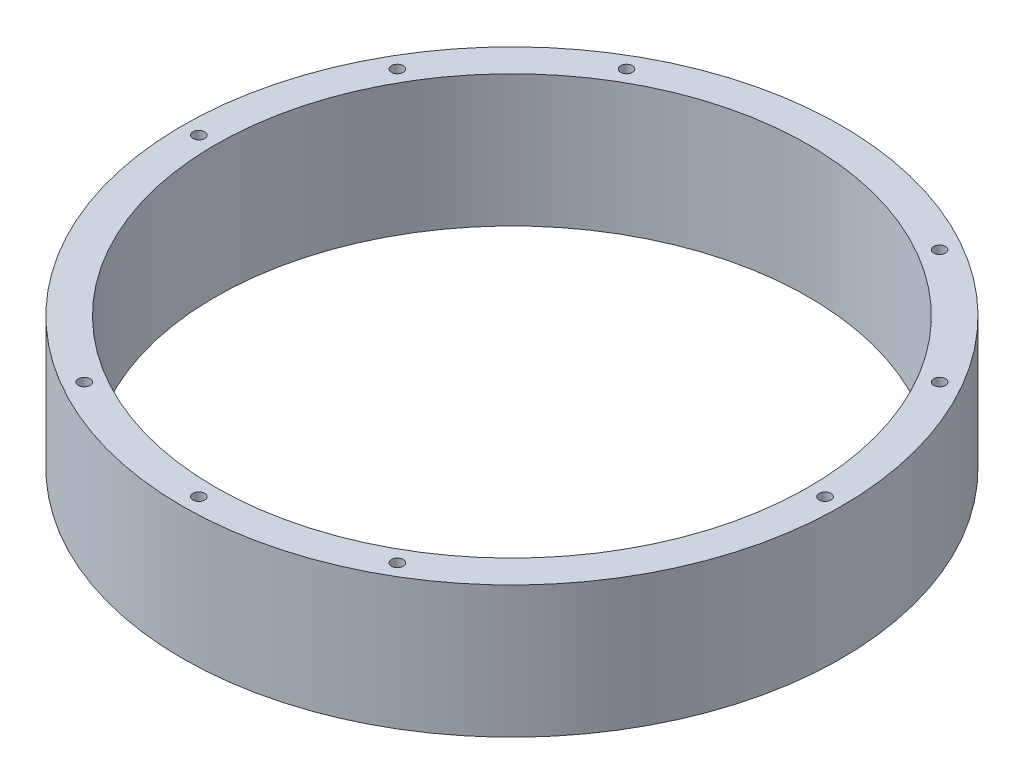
SolidWorks part; units mm, degrees
ref_plane "Front Plane" through (0, 0, 0) normal (0, 0, 1) x (1, 0, 0)
ref_plane "Top Plane" through (0, 0, 0) normal (0, 1, 0) x (1, 0, 0)
ref_plane "Right Plane" through (0, 0, 0) normal (1, 0, 0) x (0, 0, -1)
sketch "Sketch1" plane through (0, 0, 0) normal (0, 1, 0) x (1, 0, 0)
  circle A0 centre (0, 0) radius 57.15
  circle A1 centre (0, 0) radius 63.5
  dimension "D1" = 127
  dimension "D2" = 114.3
extrude "Boss-Extrude1" add sketch "Sketch1" along normal blind 25.4
sketch "Sketch2" plane through (0, 25.4, 0) normal (0, 1, 0) x (1, 0, 0)
  line L0 (0, 0) -> (0, -69.8914) construction
  line L1 (0, 0) -> (-30.1625, -52.243) construction
  line L2 (0, 0) -> (30.1625, -52.243) construction
  circle A1 centre (0, 0) radius 60.325 construction
  circle A2 centre (0, -60.325) radius 1.1303
  circle A3 centre (-30.1625, -52.243) radius 1.1303
  circle A4 centre (30.1625, -52.243) radius 1.1303
  circle A5 centre (-30.1625, 52.243) radius 1.1303
  circle A6 centre (-52.243, 30.1625) radius 1.1303
  circle A7 centre (-60.325, 0) radius 1.1303
  circle A8 centre (60.325, 0) radius 1.1303
  circle A9 centre (52.243, 30.1625) radius 1.1303
  circle A10 centre (30.1625, 52.243) radius 1.1303
  point P25 (0, 0)
  dimension "D1" = 120.65
  dimension "D4" = 2.2606
  dimension "D5" = 2.2606
  dimension "D6" = 2.2606
  dimension "D2" = 30
  dimension "D3" = 30
  dimension "D7" = 3
extrude "Cut-Extrude1" cut sketch "Sketch2" against normal through all
sketch "Sketch3" plane through (0, 0, 0) normal (0, 0, 1) x (1, 0, 0)
  line L0 (0, 0) -> (0, 25.4) construction
  line L2 (63.5, 25.4) -> (-63.5, 25.4) construction
  line L3 (63.5, 12.7) -> (-63.5, 12.7) construction
  line L6 (63.5, 0) -> (63.5, 25.4) construction
  line L7 (-63.5, 25.4) -> (-63.5, 0) construction
  line L8 (69.85, 13.4938) -> (-69.85, 13.4938)
  line L10 (69.85, 11.9063) -> (-69.85, 11.9063)
  arc A12 (-69.85, 11.9063) -> (-69.85, 13.4938) centre (-69.85, 12.7) cw
  arc A13 (69.85, 11.9063) -> (69.85, 13.4938) centre (69.85, 12.7) ccw
  point P15 (0, 13.4938)
  point P16 (0, 11.9063)
  dimension "D5" = 139.7
  dimension "D2" = 139.7
  dimension "D3" = 0.7937
  dimension "D4" = 0.7937
wrap "Wrap1" [suppressed] sketch "Sketch3" source sketch "Sketch3" thickness 8.89 parameters "D1"=8.89
